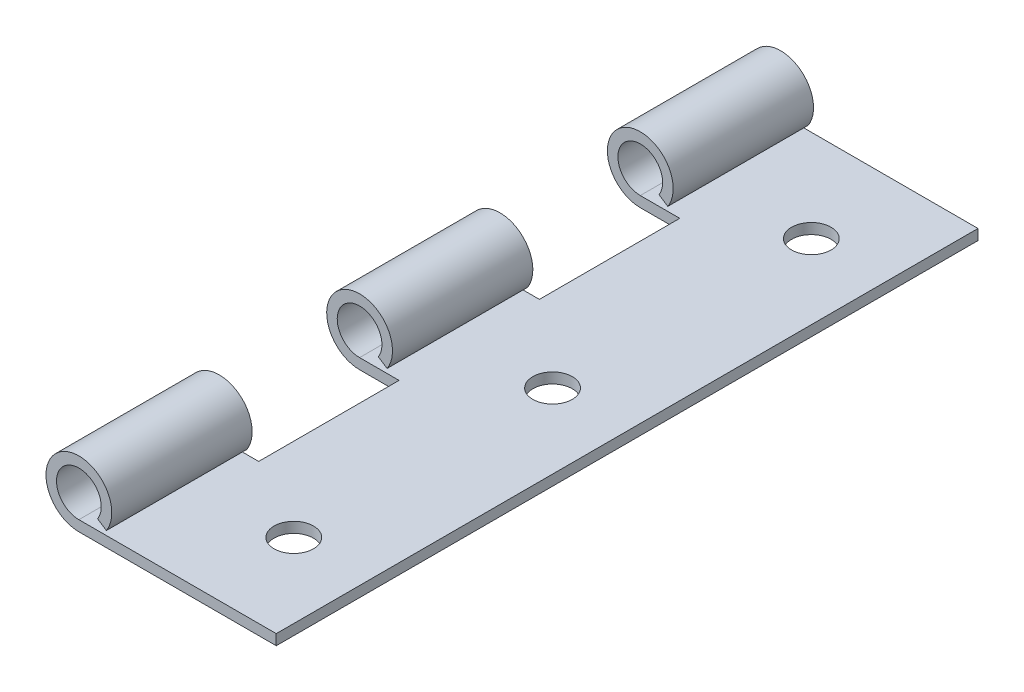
SolidWorks part; units mm, degrees
ref_plane "Plan de face" through (0, 0, 0) normal (0, 0, 1) x (1, 0, 0)
ref_plane "Plan de dessus" through (0, 0, 0) normal (0, 1, 0) x (1, 0, 0)
ref_plane "Plan de droite" through (0, 0, 0) normal (1, 0, 0) x (0, 0, -1)
sketch "Esquisse1" plane through (0, 0, 0) normal (0, 0, 1) x (1, 0, 0)
  line L0 (0, -3.75) -> (22.5, -3.75)
  line L1 (0, -2.55) -> (22.5, -2.55)
  line L2 (22.5, -2.55) -> (22.5, -3.75)
  line L3 (2.1352, -1.394) -> (3.1401, -2.05)
  line L4 (0, 0) -> (0, -2.55) construction
  arc A0 (2.1352, -1.394) -> (0, -2.55) centre (0, 0) ccw
  arc A1 (3.1401, -2.05) -> (0, -3.75) centre (0, 0) ccw
  dimension "D1" = 7.5
  dimension "D2" = 1.2
  dimension "D3" = 0.5
  dimension "D4" = 45
extrude "Boss.-Extru.1" add sketch "Esquisse1" along normal mid plane 80
sketch "Esquisse2" plane through (0, -2.55, 0) normal (0, 1, 0) x (1, 0, 0)
  line L0 (0, 0) -> (14, 0) construction
  line L1 (22.5, -40) -> (22.5, 40) construction
  circle A0 centre (14, 0) radius 2.25
  circle A1 centre (14, 29.5) radius 2.25
  circle A2 centre (14, -29.5) radius 2.25
  dimension "D1" = 8.5
  dimension "D2" = 4.5
  dimension "D3" = 59
extrude "Enlèv. mat.-Extru.1" cut sketch "Esquisse2" against normal through all
sketch "Esquisse3" plane through (0, -3.75, 0) normal (0, -1, 0) x (1, 0, 0)
  line L0 (0, 0) -> (-3.75, 0) construction
  line L1 (-3.75, 24) -> (4.5, 24)
  line L2 (-3.75, 24) -> (-3.75, 8)
  line L3 (-3.75, 8) -> (4.5, 8)
  line L4 (4.5, 24) -> (4.5, 8)
  line L5 (-3.75, 8) -> (-3.75, -8) construction
  line L6 (-3.75, 24) -> (-3.75, 40) construction
  line L7 (0, 40) -> (22.5, 40) construction
  line L8 (22.5, 40) -> (22.5, -40) construction
  line L9 (-3.75, 40) -> (-3.75, -40) construction
  line L10 (4.5, -24) -> (4.5, -8)
  line L11 (-3.75, -8) -> (4.5, -8)
  line L12 (-3.75, -24) -> (-3.75, -8)
  line L13 (-3.75, -24) -> (4.5, -24)
  dimension "D1" = 18
extrude "Enlèv. mat.-Extru.2" cut sketch "Esquisse3" against normal through all
sketch "Esquisse4" [suppressed] plane through (0, -3.75, 0) normal (0, -1, 0) x (1, 0, 0)
  line L0 (0, -40) -> (22.5, -40) construction
  line L1 (-3.75, 40) -> (4.5, 40)
  line L2 (-3.75, 40) -> (-3.75, 24)
  line L3 (-3.75, 24) -> (4.5, 24)
  line L4 (4.5, 40) -> (4.5, 24)
  line L5 (-3.75, 8) -> (4.5, 8)
  line L6 (-3.75, 8) -> (-3.75, -8)
  line L7 (-3.75, -8) -> (4.5, -8)
  line L8 (4.5, 8) -> (4.5, -8)
  line L9 (-3.75, -24) -> (4.5, -24)
  line L10 (-3.75, -24) -> (-3.75, -40)
  line L11 (-3.75, -40) -> (4.5, -40)
  line L12 (4.5, -24) -> (4.5, -40)
  line L13 (4.5, -24) -> (4.5, -8) construction
extrude "Enlèv. mat.-Extru.3" [suppressed] cut sketch "Esquisse4" against normal through all
